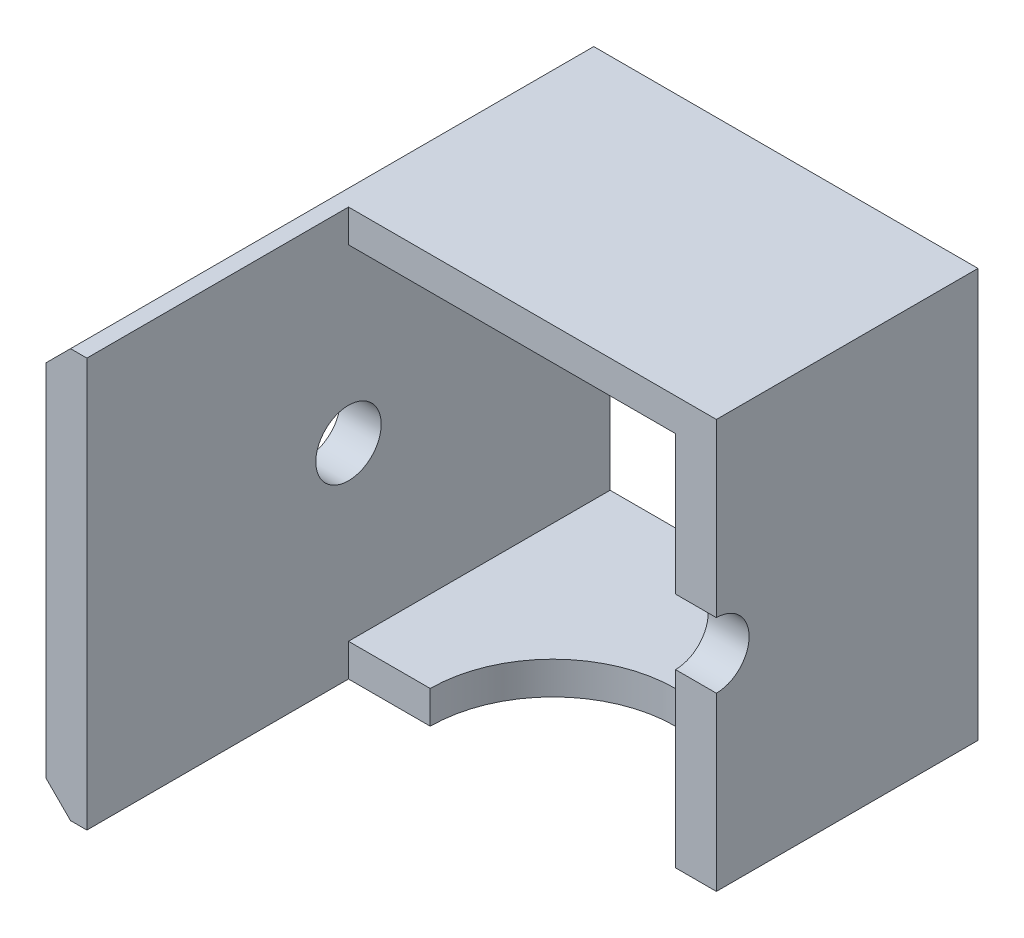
SolidWorks part; units mm, degrees
ref_plane "Face" through (0, 0, 0) normal (0, 0, 1) x (1, 0, 0)
ref_plane "Dessus" through (0, 0, 0) normal (0, 1, 0) x (1, 0, 0)
ref_plane "Droite" through (0, 0, 0) normal (1, 0, 0) x (0, 0, -1)
sketch "Esquisse1" plane through (0, 0, 0) normal (0, 0, 1) x (1, 0, 0)
  line L0 (-16.1896, 0) -> (19.4241, 0) construction
  line L1 (-2.5, 15.8521) -> (-2.5, -15.1761) construction
  line L3 (-15, 12.5) -> (10, 12.5)
  line L4 (-15, 12.5) -> (-15, -12.5)
  line L5 (-15, -12.5) -> (10, -12.5)
  line L6 (10, 12.5) -> (10, -12.5)
  line L7 (-12.5, 10.5) -> (7.5, 10.5)
  line L8 (-12.5, 10.5) -> (-12.5, -10.5)
  line L9 (-12.5, -10.5) -> (7.5, -10.5)
  line L10 (7.5, 10.5) -> (7.5, -10.5)
  dimension "D1" = 25
  dimension "D2" = 20
  dimension "D3" = 21
  dimension "D4" = 15
extrude "Base-Extrusion" add sketch "Esquisse1" along normal mid plane 32
chamfer "Chanfrein1" distance 1.5 angle 45 2 edges at (-15, 12.5, 0) (-15, -12.5, 0)
sketch "Esquisse3" plane through (0, -12.5, 0) normal (0, -1, 0) x (1, 0, 0)
  circle A0 centre (0, 0) radius 7.5
  dimension "D1" = 15
extrude "Enlèv. mat.-Extru.1" cut sketch "Esquisse3" against normal up to next
sketch "Esquisse4" plane through (10, 0, 0) normal (1, 0, 0) x (0, 0, -1)
  circle A0 centre (0, 0) radius 2
  dimension "D1" = 4
extrude "Enlèv. mat.-Extru.2" cut sketch "Esquisse4" against normal through all
sketch "Esquisse5" plane through (0, 12.5, 0) normal (0, 1, 0) x (-1, 0, 0)
  line L0 (-10, 16) -> (-10, -16) construction
  line L1 (-10, 16) -> (-10, 0)
  line L2 (12.5, 16) -> (12.5, -16) construction
  line L3 (12.5, 16) -> (12.5, 0)
  line L4 (-10, 16) -> (13.5, 16) construction
  line L5 (-10, 16) -> (12.5, 16)
  line L6 (-10, 0) -> (12.5, 0)
extrude "COUPE" cut sketch "Esquisse5" against normal up to surface (25 mm away)
